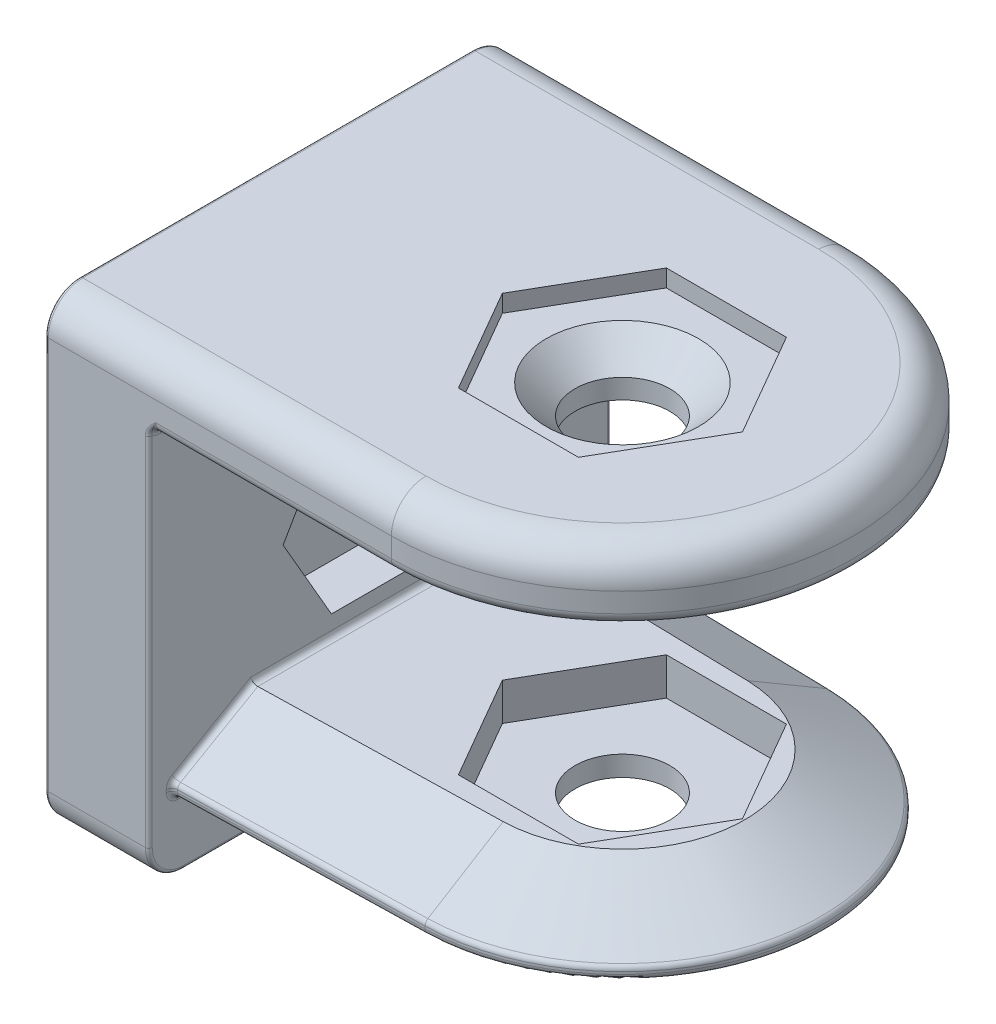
SolidWorks part; units mm, degrees
ref_plane "Face" through (0, 0, 0) normal (0, 0, 1) x (1, 0, 0)
ref_plane "Dessus" through (0, 0, 0) normal (0, 1, 0) x (1, 0, 0)
ref_plane "Droite" through (0, 0, 0) normal (1, 0, 0) x (0, 0, -1)
sketch "Esquisse1" plane through (0, 0, 0) normal (0, 0, 1) x (1, 0, 0)
  line L1 (0, 0) -> (9, 0)
  line L2 (0, 0) -> (0, 40)
  line L3 (0, 40) -> (9, 40)
  line L4 (9, 0) -> (9, 40)
  dimension "D1" = 9
  dimension "D2" = 40
extrude "Extrusion1" add sketch "Esquisse1" along normal mid plane 40
sketch "Esquisse2" plane through (0, 40, 0) normal (0, 1, 0) x (-1, 0, 0)
  line L0 (-9, 20) -> (0, 20) construction
  line L1 (0, -20) -> (-30, -20)
  line L2 (0, -20) -> (0, 20)
  line L3 (0, 20) -> (-30, 20)
  arc A0 (-30, 20) -> (-30, -20) centre (-30, 0) ccw
  dimension "D1" = 30
extrude "Extrusion2" add sketch "Esquisse2" against normal blind 5.7
fillet "Congé1" radius 3
ref_plane "Plan1" through (0, 6, 0) normal (0, 1, 0) x (-1, 0, 0)
sketch "Esquisse4" plane through (0, 6, 0) normal (0, 1, 0) x (-1, 0, 0)
  line L0 (-9, -18) -> (-9, 18)
  line L1 (-9, 18) -> (-30.4125, 17.4951)
  line L2 (-9, -18) -> (-30.4125, -17.4951)
  line L3 (-9, 20) -> (-9, -20) construction
  line L4 (0, -20) -> (-30, -20) construction
  line L5 (-30, 20) -> (0, 20) construction
  arc A0 (-30.4125, 17.4951) -> (-30.4125, -17.4951) centre (-30, 0) ccw
  arc A1 (-30, 20) -> (-30, -20) centre (-30, 0) ccw construction
  dimension "D1" = 35
  dimension "D2" = 2
  dimension "D3" = 2
extrude "Extrusion4" add sketch "Esquisse4" along normal blind 5
chamfer "Chanfrein1" distance 4 angle 60
fillet "Congé4" radius 1
fillet "Congé8" radius 0.6
sketch "Esquisse5" plane through (0, 40, 0) normal (0, 1, 0) x (-1, 0, 0)
  circle A0 centre (-30, 0) radius 4.1
  arc A1 (-30, 17) -> (-30, -17) centre (-30, 0) ccw construction
  dimension "D1" = 8.2
extrude "Enlèv. mat.-Extru.1" cut sketch "Esquisse5" against normal through all
sketch "Esquisse6" plane through (0, 40, 0) normal (0, 1, 0) x (-1, 0, 0)
  line L0 (-19.6077, 0) -> (-24.8038, -9)
  line L1 (-24.8038, -9) -> (-35.1962, -9)
  line L2 (-35.1962, -9) -> (-40.3923, 0)
  line L3 (-40.3923, 0) -> (-35.1962, 9)
  line L4 (-35.1962, 9) -> (-24.8038, 9)
  line L5 (-24.8038, 9) -> (-19.6077, 0)
  line L6 (-23.9945, 0) -> (-35.2564, 0) construction
  line L7 (-30, -5.2862) -> (-30, 4.884) construction
  circle A1 centre (-30, 0) radius 9 construction
  dimension "D1" = 18
  dimension "D2" = 60
  dimension "D3" = 60
  dimension "D4" = 60
  dimension "D5" = 240
extrude "Enlèv. mat.-Extru.2" cut sketch "Esquisse6" against normal blind 1.5
sketch "Esquisse8" plane through (0, 11, 0) normal (0, 1, 0) x (-1, 0, 0)
  line L0 (-19.6077, 0) -> (-24.8038, -9) construction
  line L1 (-24.8038, 9) -> (-19.6077, 0) construction
  line L2 (-35.1962, 9) -> (-24.8038, 9) construction
  line L3 (-40.3923, 0) -> (-35.1962, 9) construction
  line L4 (-35.1962, -9) -> (-40.3923, 0) construction
  line L5 (-24.8038, -9) -> (-35.1962, -9) construction
  line L6 (-19.6077, 0) -> (-24.8038, -9)
  line L7 (-24.8038, 9) -> (-19.6077, 0)
  line L8 (-35.1962, 9) -> (-24.8038, 9)
  line L9 (-40.3923, 0) -> (-35.1962, 9)
  line L10 (-35.1962, -9) -> (-40.3923, 0)
  line L11 (-24.8038, -9) -> (-35.1962, -9)
extrude "Enlèv. mat.-Extru.4" cut sketch "Esquisse8" against normal blind 3.25
fillet "Congé11" radius 0.5
fillet "Congé12" radius 0.5
fillet "Congé13" radius 0.5
chamfer "Chanfrein3" distance 2.5 angle 45
sketch "Esquisse10" plane through (9, 0, 0) normal (1, 0, 0) x (0, 0, -1)
  line L1 (-16.9953, 6) -> (-17.4881, 6) construction
  line L2 (0, 21) -> (0, -21) construction
  circle A0 centre (0, 20) radius 3
  dimension "D1" = 6
  dimension "D2" = 14
extrude "Enlèv. mat.-Extru.6" cut sketch "Esquisse10" against normal through all
sketch "Esquisse11" plane through (9, 0, 0) normal (1, 0, 0) x (0, 0, -1)
  line L0 (-4.1858, 27.25) -> (4.1858, 27.25)
  line L1 (4.1858, 27.25) -> (8.3716, 20)
  line L2 (8.3716, 20) -> (4.1858, 12.75)
  line L3 (4.1858, 12.75) -> (-4.1858, 12.75)
  line L4 (-4.1858, 12.75) -> (-8.3716, 20)
  line L5 (-8.3716, 20) -> (-4.1858, 27.25)
  circle A0 centre (0, 20) radius 7.25 construction
  circle A1 centre (0, 20) radius 3 construction
  dimension "D1" = 14.5
  dimension "D2" = 120
  dimension "D3" = 120
  dimension "D4" = 120
  dimension "D5" = 120
extrude "Enlèv. mat.-Extru.7" cut sketch "Esquisse11" against normal blind 4
fillet "Congé15" radius 0.3
fillet "Congé16" radius 0.3
